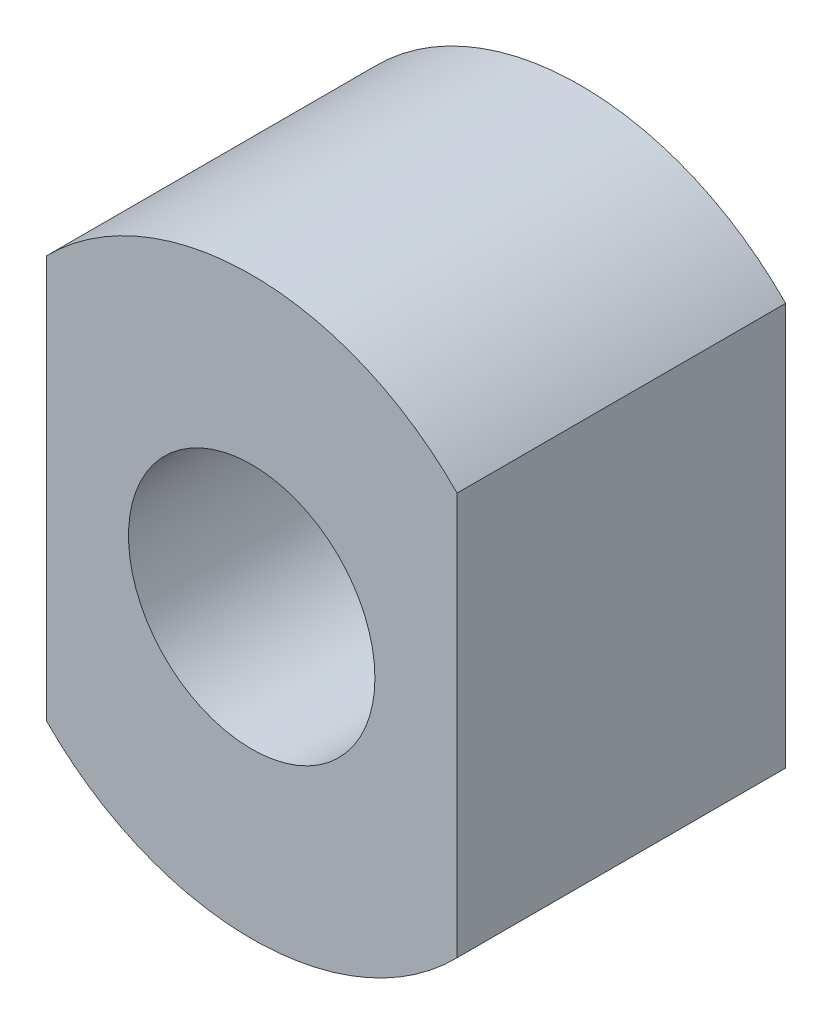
SolidWorks part; units mm, degrees
ref_plane "Face" through (0, 0, 0) normal (0, 0, 1) x (1, 0, 0)
ref_plane "Dessus" through (0, 0, 0) normal (0, 1, 0) x (1, 0, 0)
ref_plane "Droite" through (0, 0, 0) normal (1, 0, 0) x (0, 0, -1)
sketch "Esquisse1" plane through (0, 0, 0) normal (0, 0, 1) x (1, 0, 0)
  line L0 (-2.5, 2.4495) -> (-2.5, -2.4495)
  line L1 (0, 0) -> (0, 12.5864) construction
  line L2 (2.5, 2.4495) -> (2.5, -2.4495)
  arc A0 (2.5, 2.4495) -> (-2.5, 2.4495) centre (0, 0) ccw
  arc A1 (-2.5, -2.4495) -> (2.5, -2.4495) centre (0, 0) ccw
  circle A2 centre (0, 0) radius 1.5
  dimension "D1" = 7
  dimension "D3" = 3
  dimension "D2" = 5
extrude "Extrusion1" add sketch "Esquisse1" along normal blind 4
